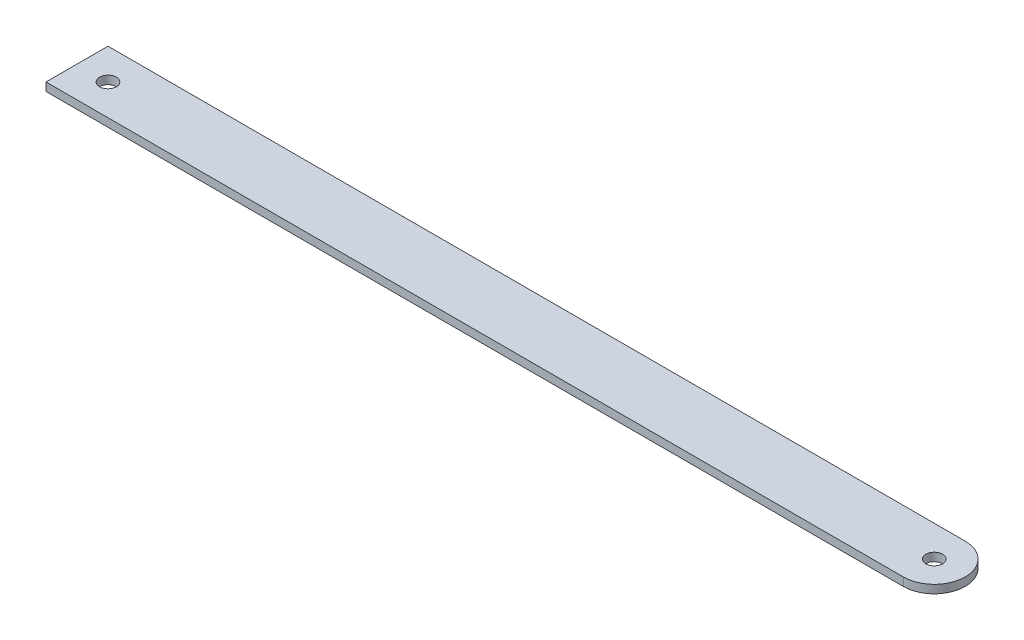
SolidWorks part; units mm, degrees
ref_plane "Piano frontale" through (0, 0, 0) normal (0, 0, 1) x (1, 0, 0)
ref_plane "Piano superiore" through (0, 0, 0) normal (0, 1, 0) x (1, 0, 0)
ref_plane "Piano destro" through (0, 0, 0) normal (1, 0, 0) x (0, 0, -1)
sketch "Schizzo2" plane through (0, 0, 0) normal (0, 1, 0) x (1, 0, 0)
  line L0 (2063.1996, 1790.2748) -> (1648.1996, 1790.2748)
  line L1 (1648.1996, 1760.2748) -> (2063.1996, 1760.2748)
  line L2 (1648.1996, 1790.2748) -> (1648.1996, 1760.2748)
  arc A0 (2063.1996, 1760.2748) -> (2063.1996, 1790.2748) centre (2063.1996, 1775.2748) ccw
  circle A1 centre (2063.1996, 1775.2748) radius 4.05
  circle A2 centre (1663.1996, 1775.2748) radius 4.05
extrude "Estrusione-Estrusione1" add sketch "Schizzo2" along normal blind 4
move or copy body "Corpo-Sposta/copia1" [suppressed] bodies to move or copy 101
